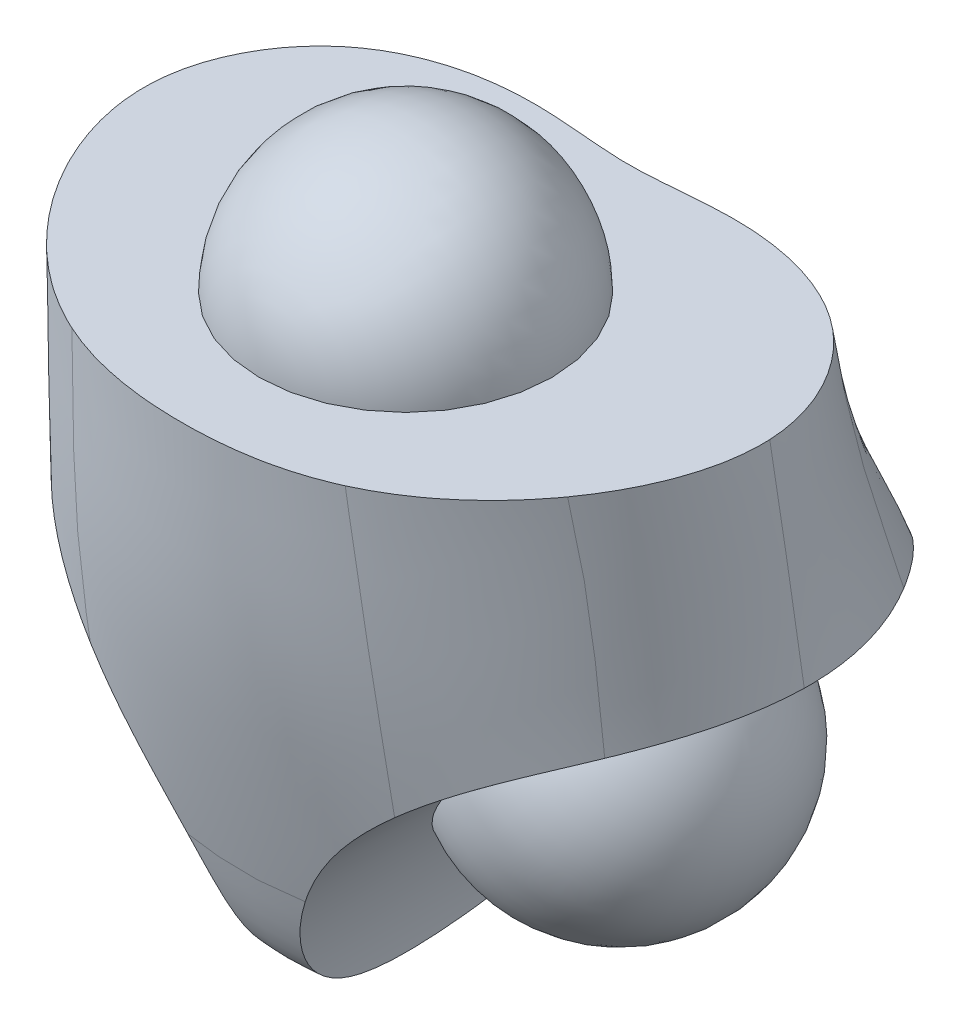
SolidWorks part; units mm, degrees
ref_plane "Front Plane" through (0, 0, 0) normal (0, 0, 1) x (1, 0, 0)
ref_plane "Top Plane" through (0, 0, 0) normal (0, 1, 0) x (1, 0, 0)
ref_plane "Right Plane" through (0, 0, 0) normal (1, 0, 0) x (0, 0, -1)
imported_body "Stock-Source-1"
sketch "Sketch2" plane through (0, 0, 0) normal (1, 0, 0) x (0, 0, -1)
  line L0 (-192.3513, 3802.4359) -> (-65.3513, 3802.4359)
  line L1 (-170.3243, 3802.4359) -> (-214.3783, 3802.4359) construction
  line L2 (-49.9726, 3802.4359) -> (-104.9892, 3802.4359) construction
  arc A0 (-65.3513, 3802.4359) -> (-192.3513, 3802.4359) centre (-128.8513, 3802.4359) ccw
  dimension "D1" = 63.5
revolve "Revolve1" add sketch "Sketch2" angle 360 about L0
ref_plane "Plane1" through (0, 0, 88.9) normal (0, 0, 1) x (1, 0, 0)
sketch "Sketch3" plane through (0, 0, 88.9) normal (0, 0, 1) x (1, 0, 0)
  line L0 (91.3149, 3691.4721) -> (14.5657, 3590.316)
  arc A0 (119.4571, 3703.966) -> (66.0743, 3673.8372) centre (170.2519, 3551.6103) ccw construction
  arc A1 (14.5657, 3590.316) -> (91.3149, 3691.4721) centre (52.9403, 3640.8941) ccw
revolve "Revolve2" add sketch "Sketch3" angle 360 about L0
mirror "Mirror1" about plane through (0, 0, 0) normal (1, 0, 0) of "Revolve2"
